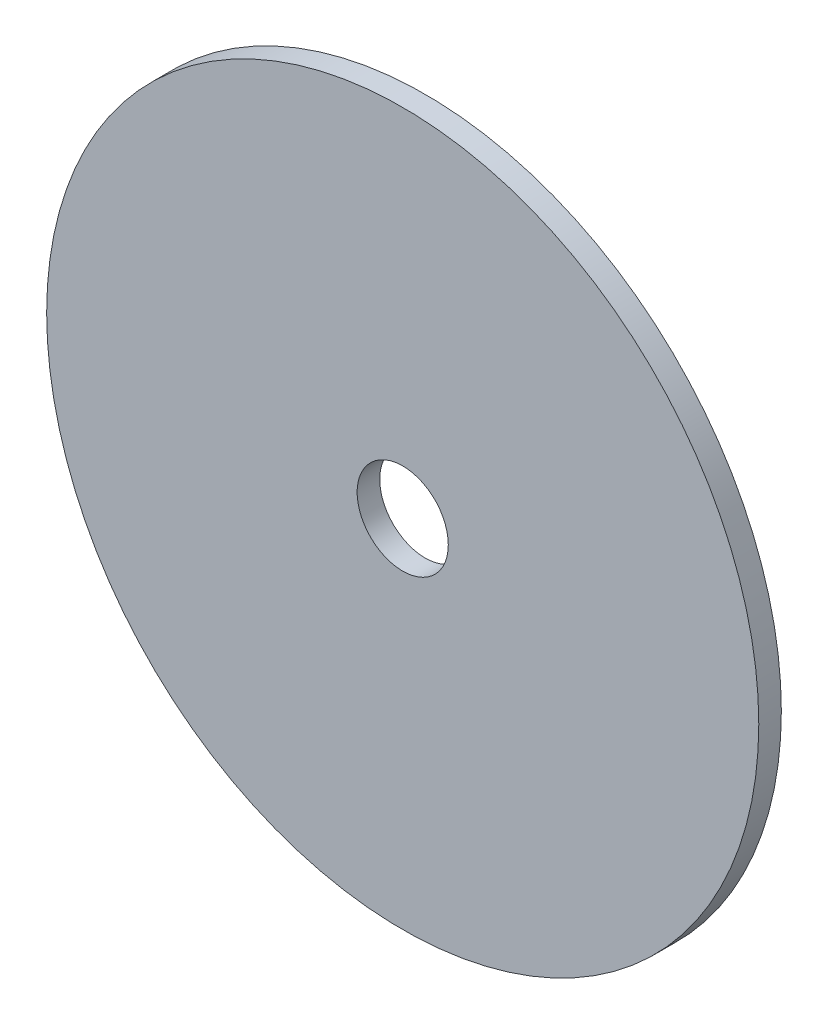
SolidWorks part; units mm, degrees
ref_plane "Front Plane" through (0, 0, 0) normal (0, 0, 1) x (1, 0, 0)
ref_plane "Top Plane" through (0, 0, 0) normal (0, 1, 0) x (1, 0, 0)
ref_plane "Right Plane" through (0, 0, 0) normal (1, 0, 0) x (0, 0, -1)
sketch "Sketch1" plane through (0, 0, 0) normal (0, 0, 1) x (1, 0, 0)
  circle A0 centre (0, 0) radius 3.2
  circle A1 centre (0, 0) radius 25
  dimension "D1" = 6.4
  dimension "D2" = 50
extrude "Boss-Extrude1" add sketch "Sketch1" along normal blind 1.5841
